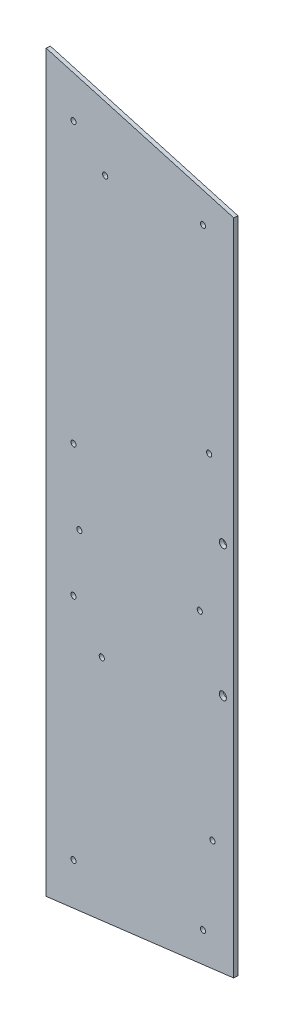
SolidWorks part; units mm, degrees
ref_plane "X-Y Datum" through (0, 0, 0) normal (0, 0, 1) x (1, 0, 0)
ref_plane "X-Z Datum" through (0, 0, 0) normal (0, 1, 0) x (1, 0, 0)
ref_plane "Y-Z Datum" through (0, 0, 0) normal (1, 0, 0) x (0, 0, -1)
ref_plane "Plane1" through (1.0099, 0, -13.5995) normal (0.0741, 0, -0.9973) x (-0.9973, 0, -0.0741)
ref_plane "Plane2" through (1.9503, 0, -26.2646) normal (0.0741, 0, -0.9973) x (-0.9973, 0, -0.0741)
sketch "Sketch1" plane through (1.9503, 0, -26.2646) normal (0.0741, 0, -0.9973) x (-0.9973, 0, -0.0741)
  line L0 (-183.6444, -298.45) -> (-183.6444, 298.45) construction
  line L1 (-183.6444, -298.45) -> (-826.7602, -177.8) construction
  line L2 (-826.7602, -177.8) -> (-826.7602, 177.8) construction
  line L3 (-826.7602, 177.8) -> (-183.6444, 298.45) construction
  line L4 (-183.6444, -298.45) -> (-183.6444, 298.45)
  line L5 (-183.6444, -298.45) -> (-826.7602, -177.8)
  line L6 (-826.7602, -177.8) -> (-826.7602, 177.8)
  line L7 (-826.7602, 177.8) -> (-183.6444, 298.45)
extrude "Boss-Extrude1" add sketch "Sketch1" along normal blind 3.175
ref_plane "Plane3" through (1.9503, 0, -26.2646) normal (-0.0741, 0, 0.9973) x (0.9973, 0, 0.0741)
sketch "Sketch2" plane through (1.9503, 0, -26.2646) normal (-0.0741, 0, 0.9973) x (0.9973, 0, 0.0741)
  circle A0 centre (0, 0) radius 14.2875
  dimension "D1" = 28.575
extrude "Cut-Extrude1" [suppressed] cut sketch "Sketch2" against normal through all contours A0
mirror "Mirror1" [suppressed] about plane through (0, 0, 0) normal (0, 1, 0)
sketch "Sketch3" plane through (1.9503, 0, -26.2646) normal (-0.0741, 0, 0.9973) x (0.9973, 0, 0.0741)
  line L0 (183.6444, 0) -> (826.7602, 0) construction
  line L1 (183.6444, -298.45) -> (183.6444, 298.45) construction
  line L2 (826.7602, 177.8) -> (826.7602, -177.8) construction
  line L3 (348.7444, 267.4769) -> (348.7444, -267.4769)
  line L4 (826.7602, -177.8) -> (183.6444, -298.45) construction
  point P11 (348.7444, 0)
  dimension "D1" = 165.1
extrude "Cut-Extrude2" cut sketch "Sketch3" against normal through all
sketch "Sketch4" plane through (2.1855, 0, -29.4309) normal (0.0741, 0, -0.9973) x (-0.9973, 0, -0.0741)
  point P0 (-321.7191, 248.0519)
  point P1 (-207.7194, 260)
  point P2 (-207.7194, 260)
  point P3 (-207.7194, 33)
  point P4 (-207.7194, -260)
  point P5 (-207.7194, -74)
  point P6 (-207.7194, -74)
  point P7 (-321.7191, -248.0519)
  point P8 (-330.0069, -180.725)
  point P9 (-330.0069, -180.725)
  point P10 (-232.6444, -104)
  point P11 (-318.8944, -25)
  point P12 (-318.8944, -25)
  point P13 (-212.8944, -25)
  point P14 (-212.8944, -25)
  point P15 (-235.6444, 236.6)
  point P16 (-235.6444, 236.6)
  point P17 (-327.1444, 90)
hole_wizard "M4 Clearance Hole1" positions "Sketch4" profile "Sketch5" hole size "M4" standard "ANSI Metric"
sketch "Sketch5" plane through (323.0212, 248.0519, -5.6065) normal (0, 1, 0) x (-0.9973, 0, -0.0741)
  line L0 (0, 0) -> (0, 15.3677)
  line L1 (0, 15.3677) -> (2.25, 15.3677)
  line L2 (2.25, 15.3677) -> (2.25, 0)
  line L5 (2.25, 0) -> (0, 0)
  line L11 (0, -6.35) -> (0, 107.95) construction
  dimension "Thru Hole Dia." = 4.5
  dimension "Thru Hole Depth" = 15.3677
sketch "Sketch6" plane through (1.9503, 0, -26.2646) normal (-0.0741, 0, 0.9973) x (0.9973, 0, 0.0741)
  line L0 (207.7194, 33) -> (348.7444, 33) construction
  line L1 (348.7444, 267.4769) -> (348.7444, -267.4769) construction
  line L2 (207.7194, -74) -> (348.7444, -74) construction
  circle A0 centre (339.2194, 33) radius 3.175
  circle A1 centre (339.2194, -74) radius 3.175
  dimension "D1" = 6.35
  dimension "D2" = 9.525
extrude "Cut-Extrude3" cut sketch "Sketch6" against normal through all
